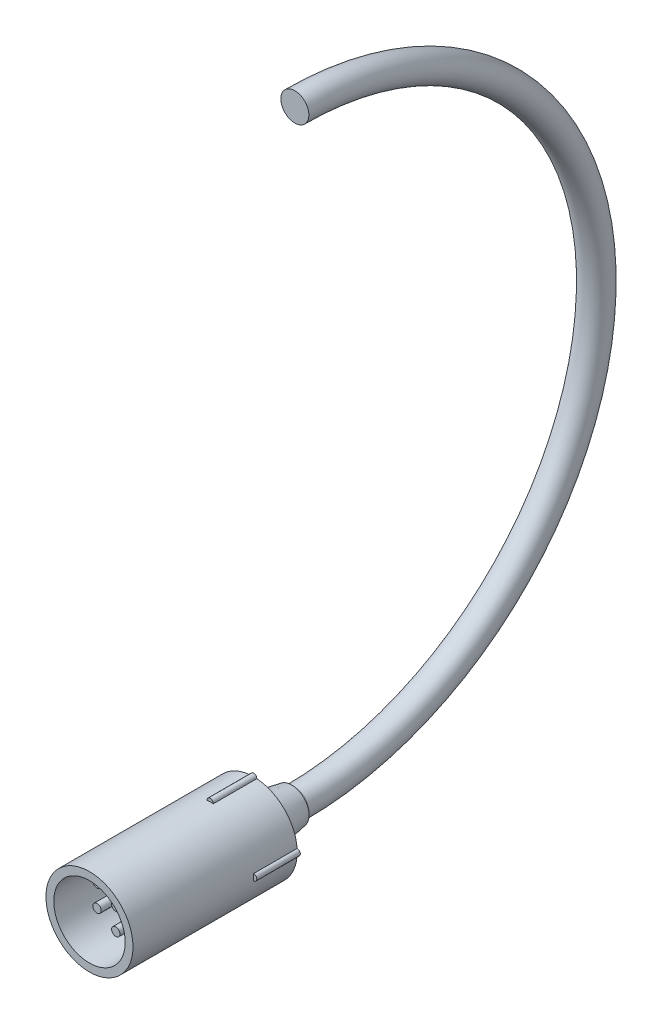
SolidWorks part; units mm, degrees
ref_plane "Front" through (0, 0, 0) normal (0, 0, 1) x (1, 0, 0)
ref_plane "Top" through (0, 0, 0) normal (0, 1, 0) x (1, 0, 0)
ref_plane "Right" through (0, 0, 0) normal (1, 0, 0) x (0, 0, -1)
sketch "Sketch1" plane through (0, 0, 0) normal (0, 0, 1) x (1, 0, 0)
  circle A0 centre (0, 0) radius 7.747
  dimension "D1" = 15.494
extrude "Extrude1" add sketch "Sketch1" against normal blind 19.05
sketch "Sketch6" plane through (0, 0, 0) normal (0, 0, 1) x (1, 0, 0)
  circle A0 centre (0, -5.4847) radius 1.382
  circle A1 centre (0, 0) radius 5.4847 construction
extrude "Extrude4" add sketch "Sketch6" along normal blind 9.525
sketch "Sketch7" plane through (0, 0, 9.525) normal (0, 0, 1) x (1, 0, 0)
  circle A0 centre (0, -5.4847) radius 1.0605
extrude "Extrude5" add sketch "Sketch7" along normal blind 4.7625
pattern_circular "CirPattern1" count 6 over 360 about axis through (0, 0, 0) along (0, 0, 1) of "Extrude4", "Extrude5"
sketch "Sketch8" plane through (0, 0, 0) normal (0, 0, 1) x (1, 0, 0)
  circle A0 centre (0, 0) radius 1.4407
extrude "Extrude6" add sketch "Sketch8" along normal up to surface (9.525 mm away)
sketch "Sketch9" plane through (0, 0, 9.525) normal (0, 0, 1) x (1, 0, 0)
  circle A0 centre (0, 0) radius 1.0686
extrude "Extrude7" add sketch "Sketch9" along normal up to surface (4.7625 mm away)
sketch "Sketch2" plane through (0, 0, -19.05) normal (0, 0, -1) x (-1, 0, 0)
  circle A0 centre (0, 0) radius 6.3528
extrude "Extrude2" add sketch "Sketch2" along normal blind 11.1125 draft 10
sketch "Sketch3" plane through (0, 0, -30.1625) normal (0, 0, -1) x (-1, 0, 0)
  circle A0 centre (0, 0) radius 3.5433
  dimension "D1" = 7.0866
extrude "Extrude3" add sketch "Sketch3" along normal blind 0.7937
sketch "Sketch10" plane through (0, 0, 0) normal (1, 0, 0) x (0, 0, -1)
  line L0 (19.0568, 6.2489) -> (19.0568, 8.157)
  line L1 (19.0568, 8.157) -> (-2.0995, 8.157)
  line L2 (-20.94, 9.0278) -> (-20.94, 11)
  line L3 (-20.94, 11) -> (20.56, 11)
  line L4 (20.56, 11) -> (20.56, 6.2489)
  line L5 (20.56, 6.2489) -> (19.0568, 6.2489)
  line L6 (0, 0) -> (43.3086, 0) construction
  line L7 (19.05, 0) -> (0, 0) construction
  line L8 (-2.0995, 8.157) -> (-2.0995, 9.0278)
  line L9 (-2.0995, 9.0278) -> (-20.94, 9.0278)
  dimension "D1" = 22
  dimension "D2" = 41.5
revolve "Revolve2" add sketch "Sketch10" angle 360 about L6
sketch "Sketch12" plane through (0, 0, -20.56) normal (0, 0, -1) x (-1, 0, 0)
  arc A0 (0.7873, 10.9718) -> (-0.7873, 10.9718) centre (0, 11) ccw
  circle A1 centre (0, 0) radius 11 construction
  arc A2 (0.7873, 10.9718) -> (-0.7873, 10.9718) centre (0, 0) ccw
extrude "Extrude8" add sketch "Sketch12" against normal blind 11
pattern_circular "CirPattern2" count 4 over 360 about axis through (0, 0, 0) along (0, 0, 1) of "Extrude8"
sketch "Sketch5" plane through (0, 0, -30.9562) normal (0, 0, -1) x (-1, 0, 0)
  line L0 (38.9767, 76.2) -> (-34.8607, 76.2) construction
  circle A1 centre (0, 0) radius 3.5433
  circle A2 centre (0, 0) radius 3.5433
  dimension "D1" = 0
revolve "Belden 3120AType3PR24" add sketch "Sketch5" angle 180 about L0
sketch "Sketch11" plane through (0, 0, -30.9563) normal (0, 0, 1) x (1, 0, 0)
  point P0 (0, 152.4)
